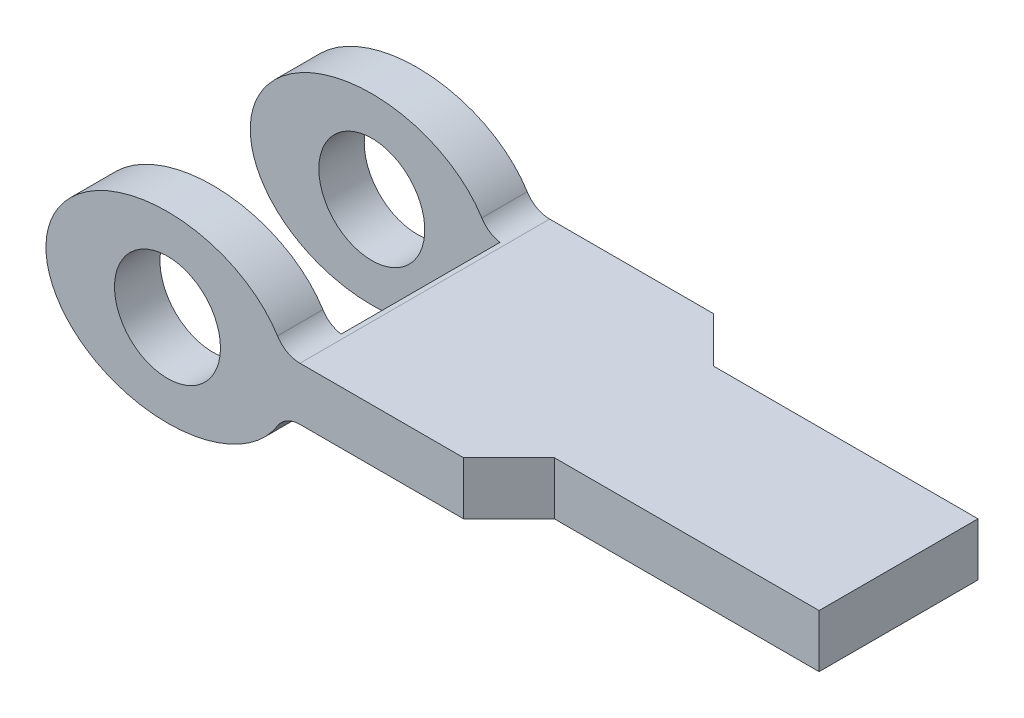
SolidWorks part; units mm, degrees
ref_plane "Płaszczyzna przednia" through (0, 0, 0) normal (0, 0, 1) x (1, 0, 0)
ref_plane "Płaszczyzna górna" through (0, 0, 0) normal (0, 1, 0) x (1, 0, 0)
ref_plane "Płaszczyzna prawa" through (0, 0, 0) normal (1, 0, 0) x (0, 0, -1)
sketch "Szkic1" plane through (0, 0, 0) normal (0, 0, 1) x (1, 0, 0)
  line L0 (10.0036, 2) -> (45.7767, 2)
  line L1 (45.7767, 2) -> (45.7767, -2)
  line L2 (45.7767, -2) -> (10.0036, -2)
  line L3 (0, 0) -> (45.7767, 0) construction
  arc A1 (10.0036, -2) -> (8.3065, -2.9417) centre (10.0036, -4) ccw
  arc A2 (10.0036, 2) -> (8.3065, 2.9417) centre (10.0036, 4) cw
  circle A3 centre (0, 0) radius 4
  ellipse E0 centre (0, 0) end of major axis (-9.178, 0) minor radius 6.9167 (8.3065, 2.9417) -> (8.3065, -2.9417) ccw
  point P12 (-4, 0)
  dimension "Promień" = 2
  dimension "Fi" = 8
  dimension "Długość" = 45.7767
  dimension "Szerokość" = 4
  dimension "G" = 13.8333
  dimension "h" = 5.178
extrude "Dodanie-wyciągnięcie1" add sketch "Szkic1" along normal mid plane 18.8571
sketch "Szkic2" plane through (0, 0, 0) normal (0, 1, 0) x (1, 0, 0)
  line L0 (-9.178, 9.4286) -> (-9.178, -9.4286) construction
  line L1 (9.678, -6) -> (-9.678, -6)
  line L2 (9.678, -6) -> (9.678, 6)
  line L3 (9.678, 6) -> (-9.678, 6)
  line L4 (-9.678, -6) -> (-9.678, 6)
  line L5 (9.678, -6) -> (-9.678, 6) construction
  line L6 (9.678, 6) -> (-9.678, -6) construction
  point P0 (0, 0)
  dimension "D1" = 0.5
  dimension "Wycięcie" = 12
extrude "Wytnij-wyciągnięcie1" cut sketch "Szkic2" against normal through all both and the other way through all
sketch "Szkic3" plane through (0, 0, 0) normal (0, 1, 0) x (1, 0, 0)
  line L0 (22.3559, 9.4286) -> (25.7845, 6)
  line L1 (45.7767, 9.4286) -> (10.0036, 9.4286) construction
  line L2 (25.7845, 6) -> (45.7767, 6)
  line L3 (45.7767, -9.4286) -> (45.7767, 9.4286) construction
  line L4 (45.7767, 6) -> (45.7767, 9.4286)
  line L5 (45.7767, 9.4286) -> (22.3559, 9.4286)
  line L6 (22.3559, -9.4286) -> (25.7845, -6)
  line L7 (45.7767, -9.4286) -> (10.0036, -9.4286) construction
  line L8 (25.7845, -6) -> (45.7767, -6)
  line L9 (45.7767, -6) -> (45.7767, -9.4286)
  line L10 (45.7767, -9.4286) -> (22.3559, -9.4286)
  line L11 (0, 0) -> (45.7767, 0) construction
  dimension "D1" = 45
  dimension "Grubość" = 12
  dimension "Odsunięcie" = 22.3559
extrude "Wytnij-wyciągnięcie2" cut sketch "Szkic3" against normal through all both and the other way through all
